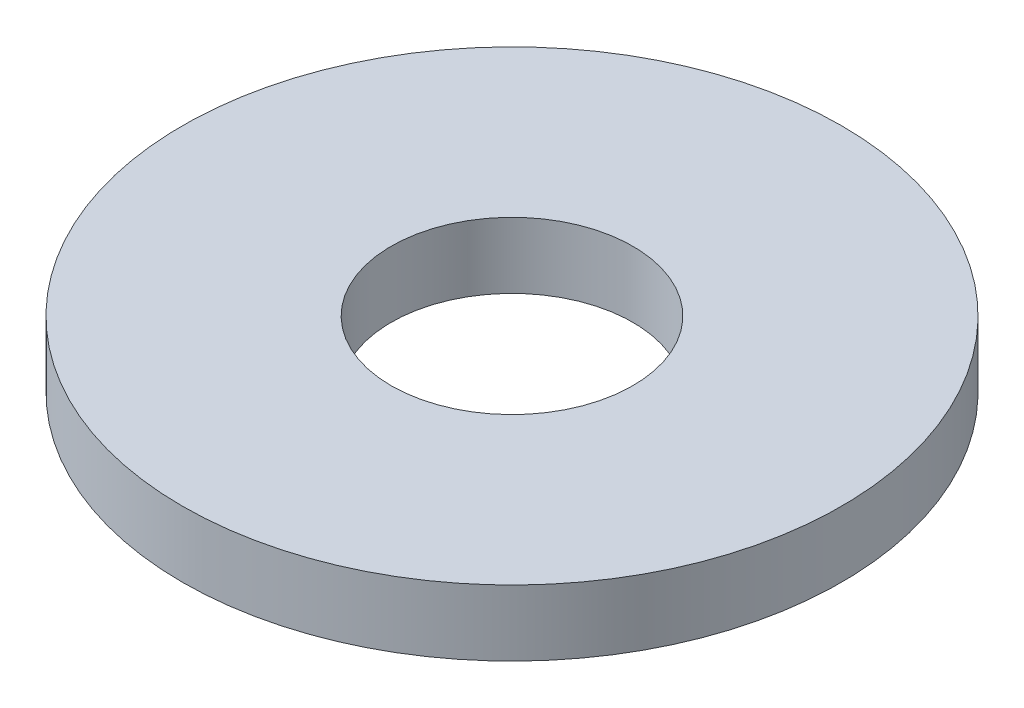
SolidWorks part; units mm, degrees
ref_plane "Front" through (0, 0, 0) normal (0, 0, 1) x (1, 0, 0)
ref_plane "Top" through (0, 0, 0) normal (0, 1, 0) x (1, 0, 0)
ref_plane "Right" through (0, 0, 0) normal (1, 0, 0) x (0, 0, -1)
sketch "Sketch1" plane through (0, 0, 0) normal (0, 1, 0) x (1, 0, 0)
  circle A0 centre (0, 0) radius 0.55
  circle A1 centre (0, 0) radius 1.5
extrude "Extrude1" add sketch "Sketch1" along normal blind 0.3
